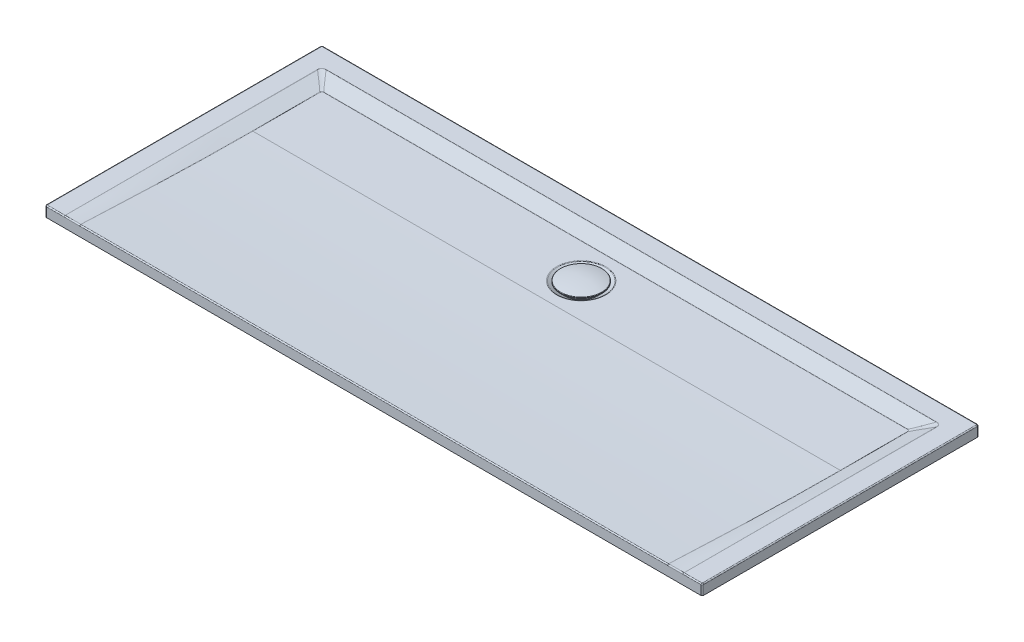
SolidWorks part; units mm, degrees
ref_plane "Płaszczyzna przednia" through (0, 0, 0) normal (0, 0, 1) x (1, 0, 0)
ref_plane "Płaszczyzna górna" through (0, 0, 0) normal (0, 1, 0) x (1, 0, 0)
ref_plane "Płaszczyzna prawa" through (0, 0, 0) normal (1, 0, 0) x (0, 0, -1)
sketch "Szkic1" plane through (0, 0, 0) normal (0, 1, 0) x (1, 0, 0)
  line L0 (0, 400) -> (0, -400) construction
  line L1 (-950, 400) -> (950, 400)
  line L2 (-950, 400) -> (-950, -400)
  line L3 (-950, -400) -> (950, -400)
  line L4 (950, 400) -> (950, -400)
  line L5 (-895, -400) -> (-895, 345)
  line L6 (-895, 345) -> (895, 345)
  line L7 (895, 345) -> (895, -400)
  line L8 (-850, -400) -> (-850, 300)
  line L9 (-850, 300) -> (850, 300)
  line L10 (850, 300) -> (850, -400)
  circle A0 centre (0, 200) radius 45
  circle A1 centre (0, 200) radius 70
  point P9 (0, 345)
  dimension "D6" = 90
  dimension "D7" = 140
  dimension "D1" = 1900
  dimension "D2" = 55
  dimension "D3" = 55
  dimension "D5" = 200
  dimension "D8" = 800
  dimension "D4" = 45
sketch "Szkic2" plane through (0, 0, 0) normal (0, 1, 0) x (1, 0, 0)
  line L0 (-950, -400) -> (950, -400) construction
  line L1 (950, 400) -> (950, -400) construction
  line L2 (895, 345) -> (895, -400) construction
  line L3 (-895, 345) -> (895, 345) construction
  line L4 (-950, 400) -> (950, 400) construction
  line L5 (-895, -400) -> (-895, 345) construction
  line L6 (-950, 400) -> (-950, -400) construction
  line L7 (-950, -400) -> (-895, -400)
  line L8 (950, 400) -> (950, -400)
  line L9 (895, 345) -> (895, -400)
  line L10 (-895, 345) -> (895, 345)
  line L11 (-950, 400) -> (950, 400)
  line L12 (-895, -400) -> (-895, 345)
  line L13 (-950, 400) -> (-950, -400)
  line L14 (895, -400) -> (950, -400)
surface "Powierzchnia-Płaszczyzna1" sketch "Szkic2"
ref_plane "Płaszczyzna1" through (0, -15, 0) normal (0, 1, 0) x (-1, 0, 0)
sketch "Szkic3" plane through (0, -15, 0) normal (0, 1, 0) x (-1, 0, 0)
  line L0 (850, -100) -> (-850, -100)
  line L1 (850, 400) -> (850, -300) construction
  line L2 (-850, -300) -> (-850, 400) construction
  line L3 (0, -100) -> (0, -300) construction
  line L4 (850, -300) -> (-850, -300) construction
  line L5 (-850, -300) -> (-850, -100)
  line L6 (850, -100) -> (850, -300)
  line L7 (850, -300) -> (-850, -300)
  circle A0 centre (0, -200) radius 70 construction
  circle A1 centre (0, -200) radius 70
  point P10 (0, -200)
surface "Powierzchnia-Płaszczyzna2" sketch "Szkic3"
sketch "Szkic4" plane through (0, 0, 0) normal (0, 1, 0) x (1, 0, 0)
  line L0 (850, -400) -> (-850, -400)
other "Granica-Powierzchnia1"
other "Granica-Powierzchnia2"
other "Granica-Powierzchnia3"
mirror "Lustro1" about plane through (0, 0, 0) normal (1, 0, 0)
sketch "Szkic5" plane through (0, 0, 0) normal (0, 1, 0) x (1, 0, 0)
  line L0 (950, 400) -> (950, -400) construction
  line L1 (-950, 400) -> (950, 400) construction
  line L2 (-950, 400) -> (-950, -400) construction
  line L3 (-950, -400) -> (950, -400) construction
  line L4 (950, 400) -> (950, -400)
  line L5 (-950, 400) -> (950, 400)
  line L6 (-950, 400) -> (-950, -400)
  line L7 (-950, -400) -> (950, -400)
surface "Powierzchnia-Wyciągnięcie1" sketch "Szkic5" parameters "D1"=30
sketch "Szkic7" plane through (0, 0, 0) normal (1, 0, 0) x (0, 0, -1)
  line L0 (200, 0) -> (200, -30) construction
  line L1 (400, -30) -> (-400, -30) construction
  line L2 (245, -30) -> (245, -28)
  line L3 (245, -28) -> (249, -28)
  line L6 (249, -28) -> (270, -15)
  dimension "D1" = 90
  dimension "D2" = 2
  dimension "D3" = 98
surface "Powierzchnia-Obrót wokół linii środkowej1" sketch "Szkic7" parameters "D1"=360
surface "Powierzchnia-Płaszczyzna3"
surface "Powierzchnia-Połącz1"
fillet "Zaokrąglenie1" radius 4 6 edges at (0, -28, -249) (0, -15, -130) (950, -15, 400) (950, -15, -400) (-950, -15, -400) (-950, -15, 400)
fillet "Zmienne zaokrąglenie1" radius 40 2 edges at (872.5, -7.5, -322.5)
fillet "Zaokrąglenie3" radius 3 12 edges
fillet "Zaokrąglenie4" radius 3 12 edges at (-948.8284, 0, -398.8284) (0, 0, -400) (948.8284, 0, -398.8284) (950, 0, 0) (948.8284, 0, 398.8284) (920.5, 0, 400) (-920.5, 0, 400) (-948.8284, 0, 398.8284) (-950, 0, 0)
sketch "Szkic8" plane through (0, 0, 0) normal (1, 0, 0) x (0, 0, -1)
  line L0 (200, 0) -> (200, -30) construction
  line L1 (200, -5.6601) -> (179.8469, -5.6601) construction
  line L2 (260, -14.7573) -> (260, -17)
  line L3 (260, -17) -> (200, -17)
  line L4 (200, -17) -> (200, -5.6601)
  line L5 (200, -5.6601) -> (199.9922, 95.6514)
  arc A0 (200, -5.6601) -> (259.2694, -13.7943) centre (200, -225.6601) cw
  arc A1 (259.2694, -13.7943) -> (260, -14.7573) centre (259, -14.7573) cw
  point P11 (260, -14)
  dimension "D1" = 220
  dimension "D4" = 1
  dimension "D2" = 60
  dimension "D3" = 3
  dimension "D5" = 13
revolve "Obrót wokół linii środkowej1" add sketch "Szkic8" angle 360 about L4
